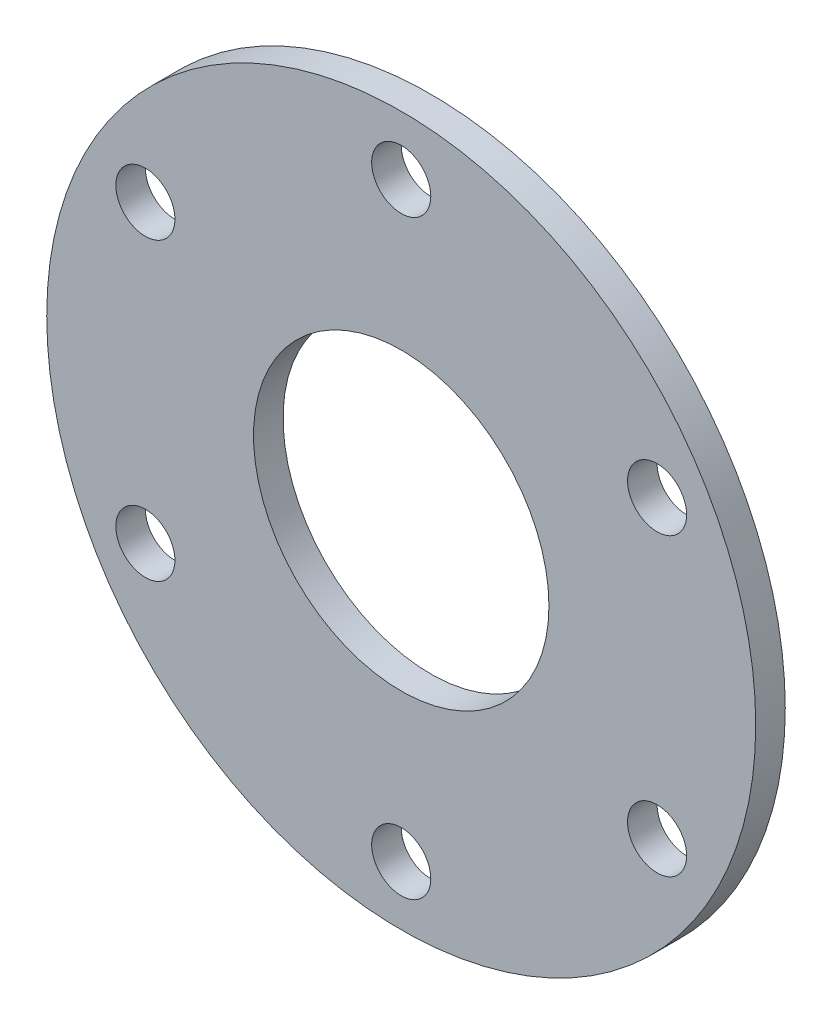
SolidWorks part; units mm, degrees
ref_plane "Front" through (0, 0, 0) normal (0, 0, 1) x (1, 0, 0)
ref_plane "Top" through (0, 0, 0) normal (0, 1, 0) x (1, 0, 0)
ref_plane "Right" through (0, 0, 0) normal (1, 0, 0) x (0, 0, -1)
sketch "Sketch1" plane through (0, 0, 0) normal (0, 0, 1) x (1, 0, 0)
  circle A0 centre (0, 0) radius 60
  circle A1 centre (0, 50) radius 5
  circle A2 centre (43.3013, 25) radius 5
  circle A3 centre (43.3013, -25) radius 5
  circle A4 centre (0, -50) radius 5
  circle A5 centre (-43.3013, -25) radius 5
  circle A6 centre (-43.3013, 25) radius 5
  circle A7 centre (0, 0) radius 50 construction
  point P14 (0, 0)
  dimension "D1" = 120
  dimension "D2" = 10
  dimension "D3" = 50
  dimension "D4" = 6
extrude "Boss-Extrude1" add sketch "Sketch1" along normal blind 5
sketch "Sketch2" plane through (0, 0, 5) normal (0, 0, 1) x (1, 0, 0)
  circle A0 centre (0, 0) radius 25
  dimension "D1" = 50
extrude "Cut-Extrude1" cut sketch "Sketch2" against normal blind 10
